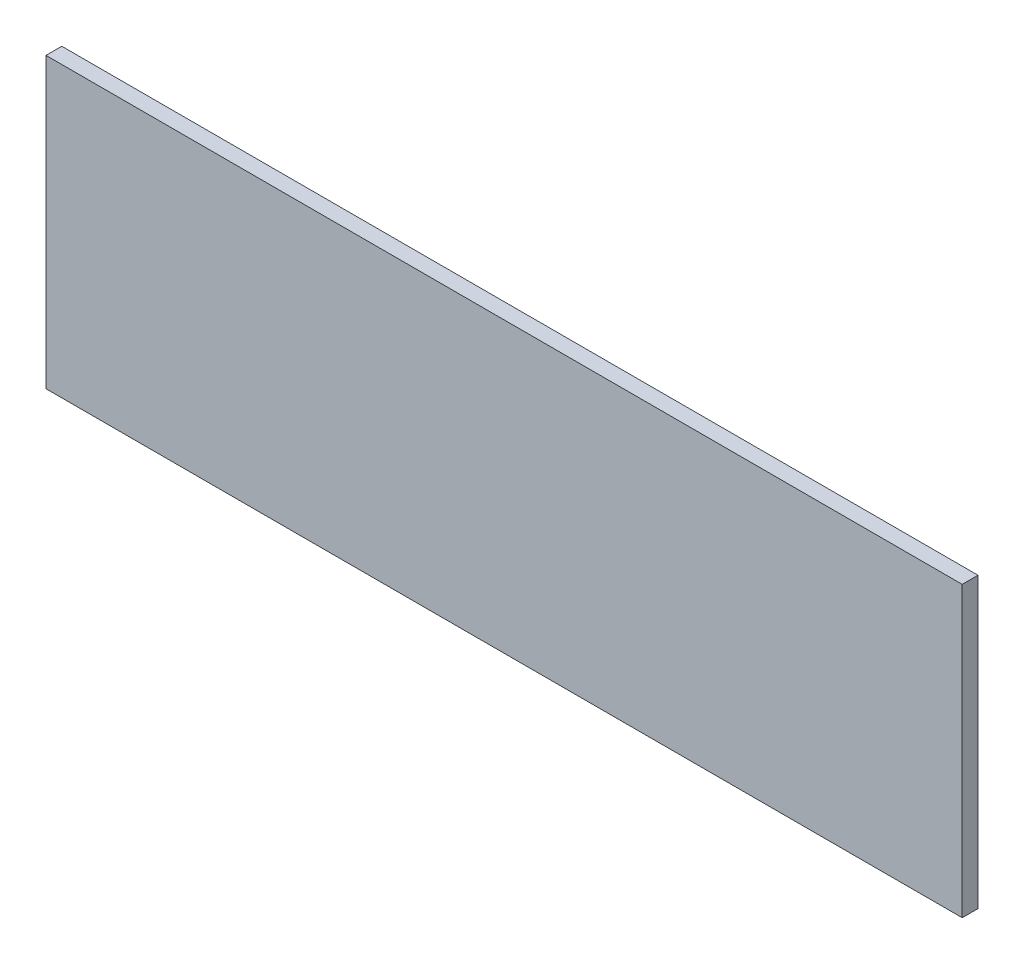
SolidWorks part; units mm, degrees
ref_plane "Plan de face" through (0, 0, 0) normal (0, 0, 1) x (1, 0, 0)
ref_plane "Plan de dessus" through (0, 0, 0) normal (0, 1, 0) x (1, 0, 0)
ref_plane "Plan de droite" through (0, 0, 0) normal (1, 0, 0) x (0, 0, -1)
sketch "Esquisse2" plane through (0, 0, 0) normal (1, 0, 0) x (0, 0, -1)
  line L12 (-402.3003, -135.4911) -> (-412.3003, -135.4911)
  line L13 (-402.3003, -135.4911) -> (-402.3003, -318.2711)
  line L14 (-402.3003, -318.2711) -> (-412.3003, -318.2711)
  line L15 (-412.3003, -135.4911) -> (-412.3003, -318.2711)
  dimension "D7" = 182.78
  dimension "D8" = 10
extrude "Boss.-Extru.1" add sketch "Esquisse2" along normal blind 600
sketch "Esquisse3" plane through (0, 0, 412.3003) normal (0, 0, 1) x (1, 0, 0)
  line L0 (600, -135.4911) -> (0, -135.4911) construction
  line L1 (300, -135.4911) -> (300, -318.2711)
  line L2 (600, -318.2711) -> (0, -318.2711) construction
  line L3 (0, -135.4911) -> (0, -318.2711) construction
  line L4 (590, -135.4911) -> (590, -318.2711)
  line L9 (0, -135.4911) -> (10, -135.4911)
  line L29 (0, -318.2711) -> (10, -318.2711)
  line L33 (10, -135.4911) -> (10, -318.2711)
  line L34 (600, -135.4911) -> (600, -318.2711)
  line L35 (0, -135.4911) -> (0, -318.2711)
  line L36 (600, -318.2711) -> (590, -318.2711)
  line L37 (600, -135.4911) -> (590, -135.4911)
  line L38 (10, -135.4911) -> (0, -135.4911)
  line L39 (10, -318.2711) -> (0, -318.2711)
  circle A0 centre (50, -239.9995) radius 14.1037
  circle A1 centre (110.8594, -218.977) radius 9.1143
  circle A2 centre (139.805, -213.5675) radius 14.3533
  circle A3 centre (169.2176, -218.977) radius 12.1539
  circle A4 centre (110.8594, -246.6507) radius 13.4765
  circle A5 centre (139.805, -239.8664) radius 14.1531
  circle A6 centre (169.2176, -246.6507) radius 14.0291
  circle A7 centre (362.5708, -226.1098) radius 15.3732
  circle A8 centre (390.4132, -199.8109) radius 12.4413
  circle A9 centre (424.0092, -193.0666) radius 14.8711
  circle A10 centre (461.4746, -193.0666) radius 12.1539
  circle A11 centre (397.3213, -241.483) radius 8.5889
  circle A12 centre (424.0092, -232.8941) radius 12.4362
  circle A13 centre (455.4494, -232.8941) radius 9.4228
  point P30 (300, -135.4911)
  dimension "D1" = 50
  dimension "D3" = 10
  dimension "D5" = 10
  dimension "D7" = 10
  dimension "D9" = 10
extrude "Enlèv. mat.-Extru.1" cut sketch "Esquisse3" against normal blind 10 contours L33 M4 M1 M2 | L34 L36 L4 L37
